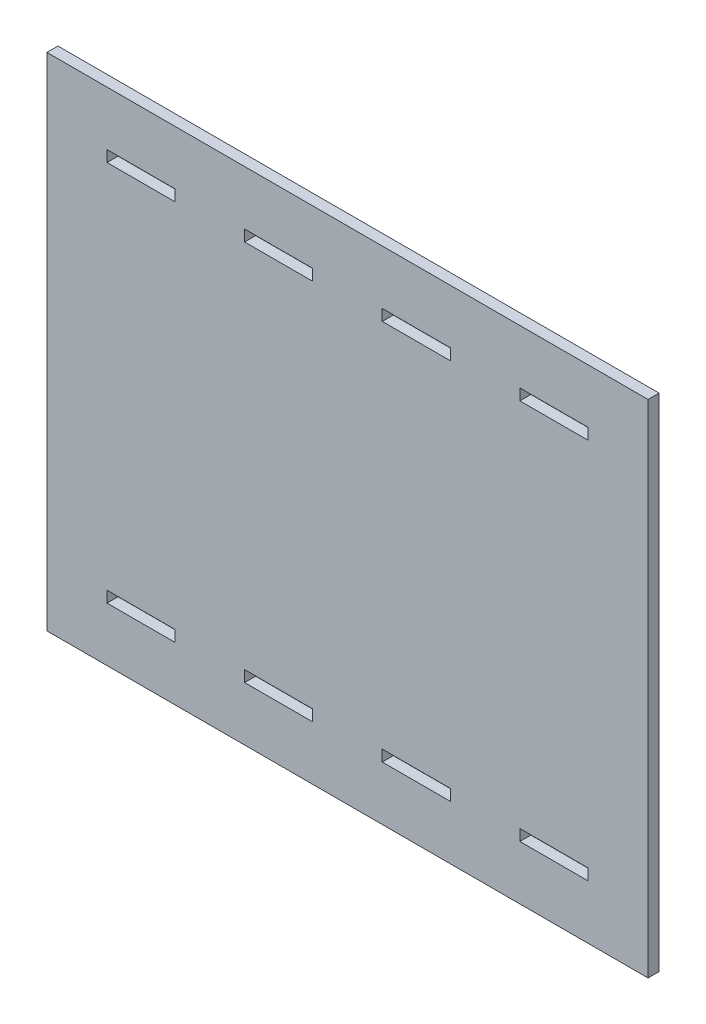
SolidWorks part; units mm, degrees
ref_plane "Alzado" through (0, 0, 0) normal (0, 0, 1) x (1, 0, 0)
ref_plane "Planta" through (0, 0, 0) normal (0, 1, 0) x (1, 0, 0)
ref_plane "Vista lateral" through (0, 0, 0) normal (1, 0, 0) x (0, 0, -1)
sketch "Croquis1" plane through (0, 0, 0) normal (0, 0, 1) x (1, 0, 0)
  line L1 (-150, 125) -> (150, 125)
  line L2 (-150, 125) -> (-150, -125)
  line L3 (-150, -125) -> (150, -125)
  line L4 (150, 125) -> (150, -125)
  line L5 (-150, 125) -> (150, -125) construction
  line L6 (-150, -125) -> (150, 125) construction
  point P0 (0, 0)
  dimension "D1" = 300
  dimension "D2" = 250
extrude "Saliente-Extruir1" add sketch "Croquis1" along normal blind 5.5
sketch "Croquis2" plane through (0, 0, 5.5) normal (0, 0, 1) x (1, 0, 0)
  line L0 (150, -125) -> (150, 125) construction
  line L1 (-150, 125) -> (-150, -125) construction
  line L2 (-120, -92.4) -> (-86, -92.4)
  line L3 (-120, -92.4) -> (-120, -98)
  line L4 (-120, -98) -> (-86, -98)
  line L5 (-86, -92.4) -> (-86, -98)
  line L6 (-51.34, -92.4) -> (-17.34, -92.4)
  line L7 (-51.34, -92.4) -> (-51.34, -98)
  line L8 (-51.34, -98) -> (-17.34, -98)
  line L9 (-17.34, -92.4) -> (-17.34, -98)
  line L10 (17.34, -92.4) -> (51.34, -92.4)
  line L11 (17.34, -92.4) -> (17.34, -98)
  line L12 (17.34, -98) -> (51.34, -98)
  line L13 (51.34, -92.4) -> (51.34, -98)
  line L14 (86, -92.4) -> (120, -92.4)
  line L15 (86, -92.4) -> (86, -98)
  line L16 (86, -98) -> (120, -98)
  line L17 (120, -92.4) -> (120, -98)
  line L18 (-120, 98) -> (-86, 98)
  line L19 (-120, 98) -> (-120, 92.4)
  line L20 (-120, 92.4) -> (-86, 92.4)
  line L21 (-86, 98) -> (-86, 92.4)
  line L22 (-51.34, 98) -> (-17.34, 98)
  line L23 (-51.34, 98) -> (-51.34, 92.4)
  line L24 (-51.34, 92.4) -> (-17.34, 92.4)
  line L25 (-17.34, 98) -> (-17.34, 92.4)
  line L26 (17.34, 98) -> (51.34, 98)
  line L27 (17.34, 98) -> (17.34, 92.4)
  line L28 (17.34, 92.4) -> (51.34, 92.4)
  line L29 (51.34, 98) -> (51.34, 92.4)
  line L30 (86, 98) -> (120, 98)
  line L31 (86, 98) -> (86, 92.4)
  line L32 (86, 92.4) -> (120, 92.4)
  line L33 (120, 98) -> (120, 92.4)
  line L34 (-150, -125) -> (150, -125) construction
  line L35 (150, 125) -> (-150, 125) construction
  point P36 (86, -95.2)
  dimension "D1" = 5.6
  dimension "D2" = 34
  dimension "D3" = 30
  dimension "D4" = 30
  dimension "D5" = 30
  dimension "D6" = 30
  dimension "D7" = 34.66
  dimension "D8" = 34.66
  dimension "D9" = 34.68
  dimension "D10" = 34.66
  dimension "D11" = 34.66
  dimension "D12" = 34.68
  dimension "D13" = 27
  dimension "D14" = 27
  dimension "D15" = 27
  dimension "D16" = 27
  dimension "D17" = 27
  dimension "D18" = 27
  dimension "D19" = 27
  dimension "D20" = 27
extrude "Cortar-Extruir1" cut sketch "Croquis2" against normal blind 5.5
